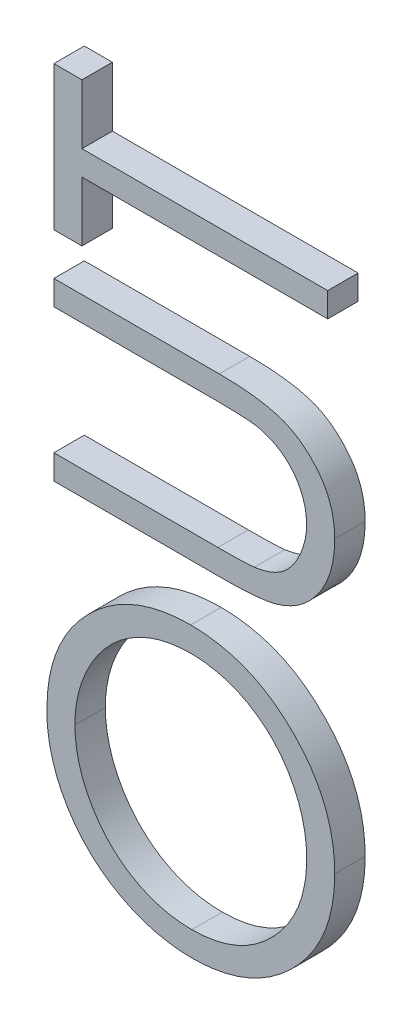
SolidWorks part; units mm, degrees
ref_plane "Piano frontale" through (0, 0, 0) normal (0, 0, 1) x (1, 0, 0)
ref_plane "Piano superiore" through (0, 0, 0) normal (0, 1, 0) x (1, 0, 0)
ref_plane "Piano destro" through (0, 0, 0) normal (1, 0, 0) x (0, 0, -1)
sketch "Schizzo2" plane through (0, 0, 0) normal (0, 0, 1) x (1, 0, 0)
  line L1 (195, 0) -> (195, 1000) construction
  text T0 "OUT  " font "Century Gothic" height 90
extrude "Estrusione-Estrusione1" add sketch "Schizzo2" along normal blind 10
